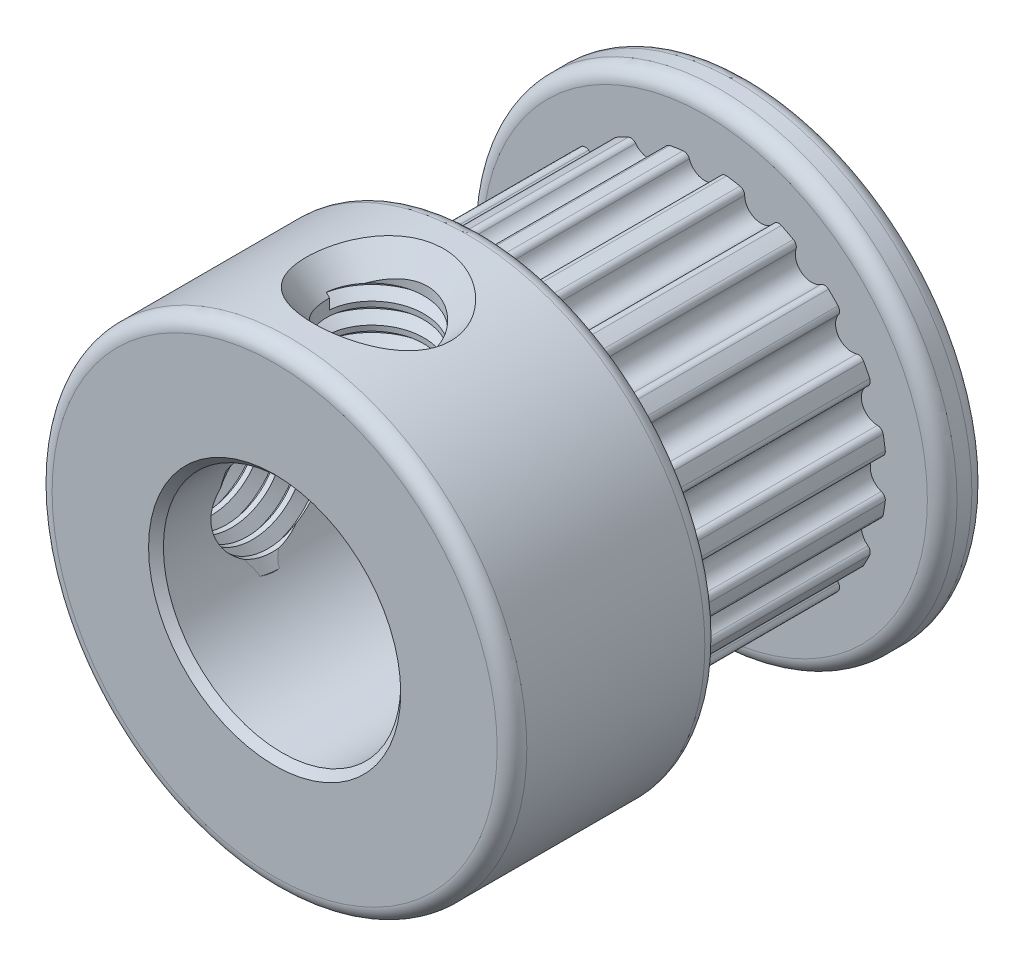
SolidWorks part; units mm, degrees
ref_plane "Front Plane" through (0, 0, 0) normal (0, 0, 1) x (1, 0, 0)
ref_plane "Top Plane" through (0, 0, 0) normal (0, 1, 0) x (1, 0, 0)
ref_plane "Right Plane" through (0, 0, 0) normal (1, 0, 0) x (0, 0, -1)
sketch "Sketch5" plane through (0, 0, 0) normal (1, 0, 0) x (0, 0, -1)
  line L0 (0, 0) -> (0, 12.2271) construction
  line L2 (3.5, 8) -> (3.5, 6.125)
  line L3 (3.5, 6.125) -> (11, 6.125)
  line L4 (11, 6.125) -> (11, 8)
  line L5 (11, 8) -> (12.5, 8)
  line L6 (12.5, 8) -> (12.5, 4)
  line L8 (0, 0) -> (15.0467, 0) construction
  line L16 (-3.5, 4) -> (12.5, 4)
  line L18 (-3.5, 8) -> (3.5, 8)
  line L19 (-3.5, 8) -> (-3.5, 4)
  point P8 (0, 8)
  dimension "D1" = 12.25
  dimension "D2" = 7.5
  dimension "D3" = 16
  dimension "D4" = 1.5
  dimension "D5" = 16
  dimension "D6" = 8
revolve "Revolve1" add sketch "Sketch5" angle 360 about L8
sketch "Sketch6" plane through (0, 0, -3.5) normal (0, 0, 1) x (1, 0, 0)
  line L0 (0, 0) -> (0, 6.125) construction
  circle A0 centre (0, 6.125) radius 0.55
  circle A2 centre (1.8927, 5.8252) radius 0.55
  circle A3 centre (3.6002, 4.9552) radius 0.55
  circle A4 centre (4.9552, 3.6002) radius 0.55
  circle A5 centre (5.8252, 1.8927) radius 0.55
  circle A6 centre (6.125, 0) radius 0.55
  circle A7 centre (5.8252, -1.8927) radius 0.55
  circle A8 centre (4.9552, -3.6002) radius 0.55
  circle A9 centre (3.6002, -4.9552) radius 0.55
  circle A10 centre (1.8927, -5.8252) radius 0.55
  circle A11 centre (0, -6.125) radius 0.55
  circle A12 centre (-1.8927, -5.8252) radius 0.55
  circle A13 centre (-3.6002, -4.9552) radius 0.55
  circle A14 centre (-4.9552, -3.6002) radius 0.55
  circle A15 centre (-5.8252, -1.8927) radius 0.55
  circle A16 centre (-6.125, 0) radius 0.55
  circle A17 centre (-5.8252, 1.8927) radius 0.55
  circle A18 centre (-4.9552, 3.6002) radius 0.55
  circle A19 centre (-3.6002, 4.9552) radius 0.55
  circle A20 centre (-1.8927, 5.8252) radius 0.55
  circle A21 centre (0, 0) radius 6.125 construction
  dimension "D1" = 1.1
  dimension "D2" = 20
extrude "Cut-Extrude1" cut sketch "Sketch6" against normal blind 7.5
fillet "Fillet2" radius 0.5 4 edges at (8, 0, -11) (8, 0, -12.5) (8, 0, 3.5) (8, 0, -3.5)
sketch "Sketch7" plane through (0, 0, -12.5) normal (0, 0, 1) x (1, 0, 0)
  circle A0 centre (0, 0) radius 5.25
  circle A1 centre (0, 0) radius 5.35
  dimension "D2" = 10.5
  dimension "D1" = 0.1
extrude "Cut-Extrude2" cut sketch "Sketch7" along normal blind 0.1
chamfer "Chamfer1" distance 0.25 angle 45 2 edges at (4, 0, -12.5) (4, 0, 3.5)
sketch "Sketch8" plane through (0, 0, 0) normal (0, 1, 0) x (1, 0, 0)
  circle A0 centre (0, 0) radius 1.65
  dimension "D1" = 3.3
extrude "Cut-Extrude3" cut sketch "Sketch8" along normal up to next
sketch "Sketch9" plane through (0, 0, 0) normal (1, 0, 0) x (0, 0, -1)
  circle A0 centre (0, 0) radius 1.65
  dimension "D1" = 3.3
extrude "Cut-Extrude4" cut sketch "Sketch9" against normal up to next
chamfer "Chamfer2" distance 1 angle 45 2 edges at (-7.9927, 0.3405, 1.6145) (-0.3405, 7.9927, 1.6145)
thread "Thread1" pitch 0.7 start angle 0, offset 0, length 7, pitch 0.7, diameter 3.3
ref_plane "Plane1" through (-1.65, 0, 0) normal (0, 0, 1) x (-1, 0, 0)
sketch "Thread Profile1" plane through (-1.65, 0, 0) normal (0, 0, 1) x (-1, 0, 0)
  line L0 (0, 0) -> (0, 0.7) construction
  line L1 (0, 0) -> (0.3789, 0.2187)
  line L2 (0.3789, 0.2187) -> (0.3789, 0.3062)
  line L3 (0.3789, 0.3062) -> (0, 0.525)
  line L4 (0.3789, 0.2625) -> (0, 0.2625) construction
  line L11 (0, 0) -> (0, 0.525)
  point P2 (0, 0)
  dimension "Pitch" = 0.7
  dimension "Profile_Angle" = 60
  dimension "Profile_Land" = 0.0875
  dimension "Profile_Height" = 0.3789
thread "Thread3" pitch 0.7 start angle 0, offset 0, length 7, pitch 0.7, diameter 3.3
ref_plane "Plane3" through (0, 0, -1.65) normal (0, -1, 0) x (0, 0, -1)
sketch "Thread Profile3" plane through (0, 0, -1.65) normal (0, -1, 0) x (0, 0, -1)
  line L0 (0, 0) -> (0, 0.7) construction
  line L1 (0, 0) -> (0.3789, 0.2187)
  line L2 (0.3789, 0.2187) -> (0.3789, 0.3062)
  line L3 (0.3789, 0.3062) -> (0, 0.525)
  line L4 (0.3789, 0.2625) -> (0, 0.2625) construction
  line L11 (0, 0) -> (0, 0.525)
  point P2 (0, 0)
  dimension "Pitch" = 0.7
  dimension "Profile_Angle" = 60
  dimension "Profile_Land" = 0.0875
  dimension "Profile_Height" = 0.3789
sketch "Sketch16" plane through (0, 0, 0) normal (0, 0, 1) x (1, 0, 0)
  line L0 (0, 0) -> (0, 8) construction
  line L1 (0, 0) -> (-8, 0) construction
  dimension "D1" = 8
fillet "Fillet3" radius 0.2 40 edges at (-4.6123, 4.0302, -7.25) (-5.2582, 3.1412, -7.25) (-3.1412, 5.2582, -7.25) (-4.0302, 4.6123, -7.25) (-1.3625, 5.9715, -7.25) (-2.4077, 5.6319, -7.25) (0.5494, 6.1003, -7.25) (-0.5494, 6.1003, -7.25) (2.4077, 5.6319, -7.25) (1.3625, 5.9715, -7.25) (4.0302, 4.6123, -7.25) (3.1412, 5.2582, -7.25) (5.2582, 3.1412, -7.25) (4.6123, 4.0302, -7.25) (5.9715, 1.3625, -7.25) (5.6319, 2.4077, -7.25) (6.1003, -0.5494, -7.25) (6.1003, 0.5494, -7.25) (5.6319, -2.4077, -7.25) (5.9715, -1.3625, -7.25) (4.6123, -4.0302, -7.25) (5.2582, -3.1412, -7.25) (3.1412, -5.2582, -7.25) (4.0302, -4.6123, -7.25) (1.3625, -5.9715, -7.25) (2.4077, -5.6319, -7.25) (-0.5494, -6.1003, -7.25) (0.5494, -6.1003, -7.25) (-2.4077, -5.6319, -7.25) (-1.3625, -5.9715, -7.25) (-4.0302, -4.6123, -7.25) (-3.1412, -5.2582, -7.25) (-5.2582, -3.1412, -7.25) (-4.6123, -4.0302, -7.25) (-5.9715, -1.3625, -7.25) (-5.6319, -2.4077, -7.25) (-6.1003, 0.5494, -7.25) (-6.1003, -0.5494, -7.25) (-5.6319, 2.4077, -7.25) (-5.9715, 1.3625, -7.25)
